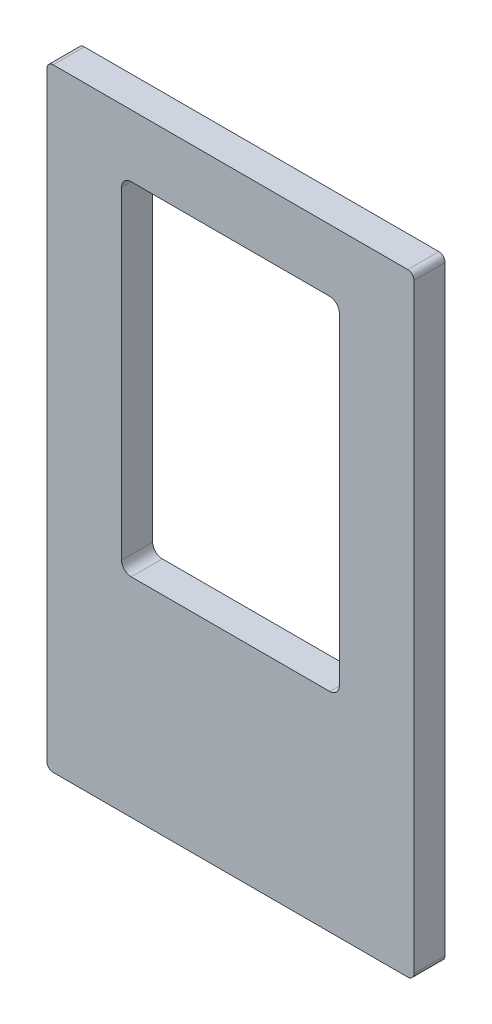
SolidWorks part; units mm, degrees
ref_plane "Plan de face" through (0, 0, 0) normal (0, 0, 1) x (1, 0, 0)
ref_plane "Plan de dessus" through (0, 0, 0) normal (0, 1, 0) x (1, 0, 0)
ref_plane "Plan de droite" through (0, 0, 0) normal (1, 0, 0) x (0, 0, -1)
sketch "Esquisse2" plane through (0, 0, 0) normal (0, 0, 1) x (1, 0, 0)
  line L1 (-71.565, 146.9056) -> (42.435, 146.9056)
  line L2 (-73.565, 144.9056) -> (-73.565, -48.0944)
  line L3 (-71.565, -50.0944) -> (42.435, -50.0944)
  line L4 (44.435, 144.9056) -> (44.435, -48.0944)
  arc A0 (-71.565, 146.9056) -> (-73.565, 144.9056) centre (-71.565, 144.9056) ccw
  arc A1 (42.435, 146.9056) -> (44.435, 144.9056) centre (42.435, 144.9056) cw
  arc A2 (42.435, -50.0944) -> (44.435, -48.0944) centre (42.435, -48.0944) ccw
  arc A3 (-73.565, -48.0944) -> (-71.565, -50.0944) centre (-71.565, -48.0944) ccw
  dimension "D3" = 2
  dimension "D1" = 118
  dimension "D2" = 197
extrude "Boss.-Extru.1" add sketch "Esquisse2" along normal blind 10
sketch "Esquisse3" plane through (0, 0, 0) normal (0, 0, -1) x (-1, 0, 0)
  line L0 (-61.4925, 16.9056) -> (82.0767, 16.9056) construction
  line L1 (49.565, 166.7647) -> (49.565, 0) construction
  line L2 (-20.435, 177.0196) -> (-20.435, 2.6856) construction
  line L3 (73.565, 144.9056) -> (73.565, -48.0944) construction
  line L4 (-42.435, 146.9056) -> (71.565, 146.9056) construction
  line L5 (-61.4925, 126.9056) -> (62.8486, 126.9056) construction
  line L7 (-17.335, 126.9056) -> (46.465, 126.9056)
  line L8 (-20.435, 123.8056) -> (-20.435, 20.0056)
  line L9 (-17.335, 16.9056) -> (46.465, 16.9056)
  line L10 (49.565, 123.8056) -> (49.565, 20.0056)
  arc A0 (-20.435, 20.0056) -> (-17.335, 16.9056) centre (-17.335, 20.0056) ccw
  arc A1 (46.465, 16.9056) -> (49.565, 20.0056) centre (46.465, 20.0056) ccw
  arc A2 (46.465, 126.9056) -> (49.565, 123.8056) centre (46.465, 123.8056) cw
  arc A3 (-17.335, 126.9056) -> (-20.435, 123.8056) centre (-17.335, 123.8056) ccw
  point P20 (49.565, 16.9056)
  point P25 (-20.435, 126.9056)
  dimension "D5" = 3.1
  dimension "D1" = 24
  dimension "D2" = 70
  dimension "D3" = 130
  dimension "D4" = 20
extrude "Enlèv. mat.-Extru.1" cut sketch "Esquisse3" against normal through all
